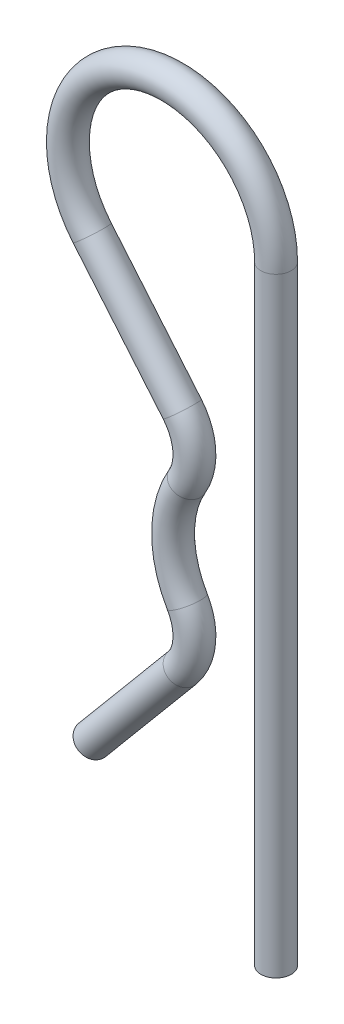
SolidWorks part; units mm, degrees
ref_plane "Plan1" through (0, 0, 0) normal (0, 0, 1) x (1, 0, 0)
ref_plane "Plan2" through (0, 0, 0) normal (0, 1, 0) x (1, 0, 0)
ref_plane "Plan3" through (0, 0, 0) normal (1, 0, 0) x (0, 0, -1)
sketch "Esquisse1" plane through (0, 0, 0) normal (0, 0, 1) x (1, 0, 0)
  line L0 (0, 0) -> (0, 47.125) construction
  line L1 (-21.1988, 25.3056) -> (-10.8127, 12.9074) construction
  line L2 (0, 0) -> (-47.125, 0) construction
  line L4 (0, 33.0116) -> (0, 0) construction
  line L5 (0, 0) -> (0, -37.2384) construction
  line L6 (-12, 45.0116) -> (0, 45.0116) construction
  line L7 (-21.1988, -25.3056) -> (-10.8127, -12.9074) construction
  circle A0 centre (0, 0) radius 47.125 construction
  arc A1 (0, 33.0116) -> (-21.1988, 25.3056) centre (-12, 33.0116) ccw construction
  arc A2 (-10.2388, 6.0152) -> (-10.2388, -6.0152) centre (0, 0) ccw construction
  arc A3 (-10.8127, 12.9074) -> (-10.2388, 6.0152) centre (-15.4121, 9.0544) cw construction
  arc A5 (-10.2388, -6.0152) -> (-10.8127, -12.9074) centre (-15.4121, -9.0544) cw
  dimension "D1" = 94.25
  dimension "D2" = 24
  dimension "D3" = 23.75
  dimension "D7" = 6
  dimension "D4" = 6
  dimension "D6" = 82.25
sketch "Esquisse4" plane through (0, 0, 0) normal (0, 0, 1) x (1, 0, 0)
  line L7 (0, -37.2384) -> (0, 33.0116)
  line L8 (-21.1988, 25.3056) -> (-10.8127, 12.9074) construction
  line L9 (-21.1988, 25.3056) -> (-10.8127, 12.9074)
  line L10 (-21.1988, -25.3056) -> (-10.8127, -12.9074) construction
  line L11 (-21.1988, -25.3056) -> (-10.8127, -12.9074)
  arc A7 (0, 33.0116) -> (-21.1988, 25.3056) centre (-12, 33.0116) ccw construction
  arc A8 (0, 33.0116) -> (-21.1988, 25.3056) centre (-12, 33.0116) ccw
  arc A9 (-10.8127, -12.9074) -> (-10.2388, -6.0152) centre (-15.4121, -9.0544) ccw construction
  arc A10 (-10.2388, 6.0152) -> (-10.2388, -6.0152) centre (0, 0) ccw construction
  arc A11 (-10.2388, 6.0152) -> (-10.8127, 12.9074) centre (-15.4121, 9.0544) ccw construction
  arc A12 (-10.8127, -12.9074) -> (-10.2388, -6.0152) centre (-15.4121, -9.0544) ccw
  arc A13 (-10.2388, 6.0152) -> (-10.2388, -6.0152) centre (0, 0) ccw
  arc A14 (-10.2388, 6.0152) -> (-10.8127, 12.9074) centre (-15.4121, 9.0544) ccw
ref_plane "Plan5" through (0, -37.2384, 0) normal (0, 1, 0) x (-1, 0, 0)
sketch "Esquisse2" plane through (0, -37.2384, 0) normal (0, 1, 0) x (1, 0, 0)
  circle A0 centre (0, 0) radius 1.75
  dimension "D1" = 3.5
sweep "Base-Balayage" add profiles "Esquisse2" path "Esquisse4"
ref_plane "Plan6" through (0, 0, 10) normal (0, 0, 1) x (1, 0, 0)
equation "\"D7@Esquisse1\"=\"D2@Esquisse1\"/4"
equation "\"D4@Esquisse1\"=\"D7@Esquisse1\""
